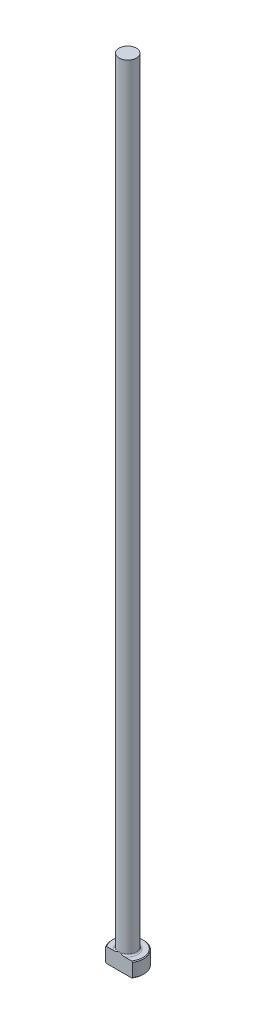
SolidWorks part; units mm, degrees
ref_plane "Front Plane" through (0, 0, 0) normal (0, 0, 1) x (1, 0, 0)
ref_plane "Top Plane" through (0, 0, 0) normal (0, 1, 0) x (1, 0, 0)
ref_plane "Right Plane" through (0, 0, 0) normal (1, 0, 0) x (0, 0, -1)
sketch "Sketch1" plane through (0, 0, 0) normal (0, 0, 1) x (1, 0, 0)
  line L0 (0, 259.9588) -> (0, -15.1925) construction
  line L1 (0, 0) -> (-5.1562, 0)
  line L2 (-5.1562, 0) -> (-5.1562, 4.7498)
  line L3 (-5.1562, 4.7498) -> (-2.7775, 4.7498)
  line L4 (-2.7775, 4.7498) -> (-2.7775, 254)
  line L5 (-2.7775, 254) -> (0, 254)
  line L6 (0, 254) -> (0, 0)
  dimension "L" = 254
  dimension "H" = 10.3124
  dimension "T" = 4.7498
  dimension "D" = 5.555
revolve "Revolve1" add sketch "Sketch1" angle 360 about L0
chamfer "Chamfer1" distance 0.254 angle 45 2 edges at (0, 4.7498, 5.1562) (0, 0, 5.1562)
fillet "Fillet1" radius 0.508 1 edges at (0, 4.7498, 2.7775)
sketch "Sketch2" plane through (0, 0, 0) normal (0, 1, 0) x (1, 0, 0)
  line L0 (-4.3442, -2.7775) -> (4.3442, -2.7775)
  circle A0 centre (0, 0) radius 5.1562 construction
  arc A1 (-4.3442, -2.7775) -> (4.3442, -2.7775) centre (0, 0) ccw
  circle A3 centre (0, 0) radius 2.7775 construction
  dimension "D1" = 0
extrude "Key" cut sketch "Sketch2" along normal through all
sketch "Pocket Sketch" plane through (0, 0, 0) normal (0, 0, 1) x (1, 0, 0)
  line L0 (-5.5531, 0) -> (-5.5531, 4.7752)
  line L1 (-5.5531, 4.7752) -> (-3.7379, 4.7752)
  line L2 (-2.9759, 5.5372) -> (-2.9759, 22.225)
  line L3 (-2.9759, 22.225) -> (0, 22.225)
  line L4 (0, 22.225) -> (0, 0)
  line L5 (0, 0) -> (-5.5531, 0)
  line L6 (0, 12.6104) -> (0, -2.4989) construction
  line L7 (-5.1562, 4.4958) -> (-5.1562, 0.254) construction
  line L8 (4.9022, 4.7498) -> (-4.9022, 4.7498) construction
  line L9 (-2.7775, 254) -> (-2.7775, 5.2578) construction
  line L10 (-3.7379, 4.7752) -> (-2.9759, 5.5372)
  point P3 (-2.9759, 4.7752)
  dimension "D1" = 11.1061
  dimension "D2" = 0.3969
  dimension "D3" = 0.0254
  dimension "D4" = 0.1984
  dimension "D5" = 5.9519
  dimension "D6" = 22.225
